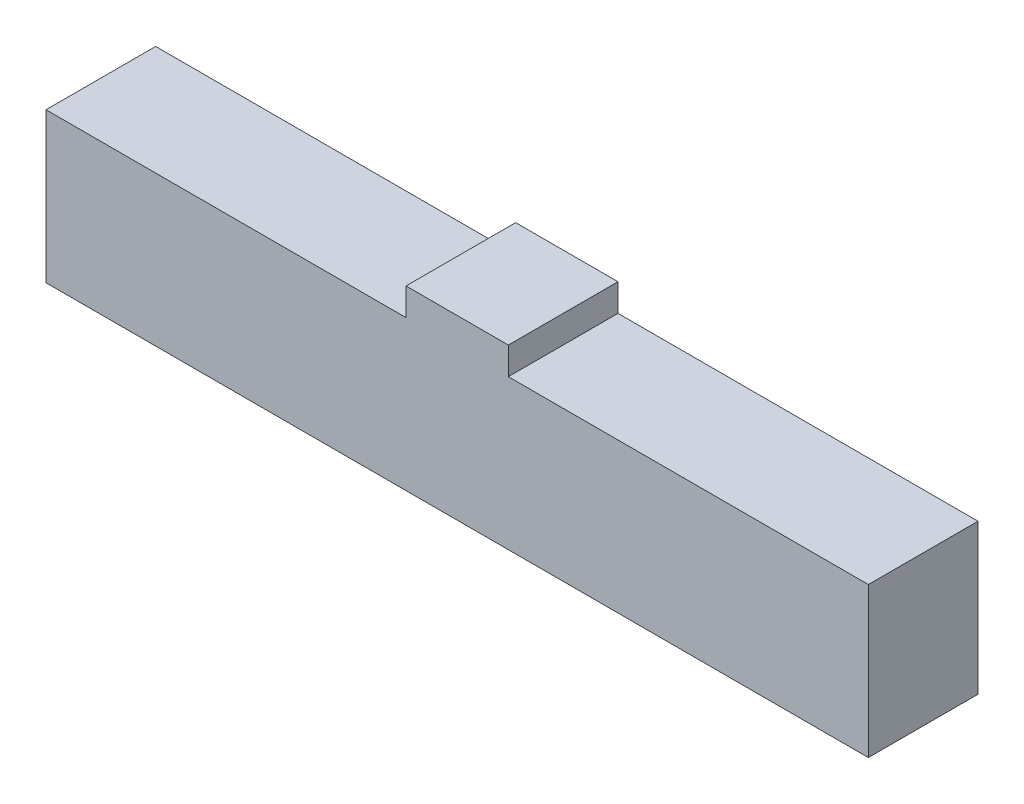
SolidWorks part; units mm, degrees
ref_plane "Front Plane" through (0, 0, 0) normal (0, 0, 1) x (1, 0, 0)
ref_plane "Top Plane" through (0, 0, 0) normal (0, 1, 0) x (1, 0, 0)
ref_plane "Right Plane" through (0, 0, 0) normal (1, 0, 0) x (0, 0, -1)
sketch "Sketch1" plane through (0, 0, 0) normal (0, 0, 1) x (1, 0, 0)
  line L0 (-21.5, 3.1) -> (-1.8, 3.1)
  line L1 (-21.5, -3.1) -> (21.5, -3.1)
  line L2 (-21.5, -3.1) -> (-21.5, 3.1)
  line L3 (-1.8, 3.1) -> (-1.8, 4.6)
  line L4 (21.5, -3.1) -> (21.5, 3.1)
  line L5 (-21.5, -3.1) -> (21.5, 3.1) construction
  line L6 (-21.5, 3.1) -> (21.5, -3.1) construction
  line L7 (-1.8, 4.6) -> (-0.4, 4.6)
  line L8 (-0.4, 4.6) -> (-0.4, 3.1)
  line L9 (-0.4, 3.1) -> (0.4, 3.1)
  line L10 (0.4, 3.1) -> (0.4, 4.6)
  line L11 (0.4, 4.6) -> (1.8, 4.6)
  line L12 (1.8, 4.6) -> (1.8, 3.1)
  line L13 (1.8, 3.1) -> (21.5, 3.1)
  point P0 (0, 0)
  dimension "D1" = 43
  dimension "D2" = 6.2
  dimension "D3" = 0.8
  dimension "D4" = 3.6
  dimension "D5" = 7.7
extrude "Extrude-Thin1" add sketch "Sketch1" along normal blind 6 thin
sketch "Sketch2" plane through (0, 0, 6) normal (0, 0, 1) x (1, 0, 0)
  line L8 (22.5, 4.1) -> (2.8, 4.1)
  line L9 (2.8, 4.1) -> (2.8, 5.6)
  line L10 (2.8, 5.6) -> (-2.8, 5.6)
  line L11 (-2.8, 5.6) -> (-2.8, 4.1)
  line L12 (-2.8, 4.1) -> (-22.5, 4.1)
  line L13 (-22.5, 4.1) -> (-22.5, -4.1)
  line L14 (-22.5, -4.1) -> (22.5, -4.1)
  line L15 (22.5, -4.1) -> (22.5, 4.1)
  line L16 (22.5, 4.1) -> (2.8, 4.1)
  line L17 (2.8, 4.1) -> (2.8, 5.6)
  line L18 (2.8, 5.6) -> (-2.8, 5.6)
  line L19 (-2.8, 5.6) -> (-2.8, 4.1)
  line L20 (-2.8, 4.1) -> (-22.5, 4.1)
  line L21 (-22.5, 4.1) -> (-22.5, -4.1)
  line L22 (-22.5, -4.1) -> (22.5, -4.1)
  line L23 (22.5, -4.1) -> (22.5, 4.1)
  dimension "D1" = 0
extrude "Extrude1" add sketch "Sketch2" against normal blind 1
